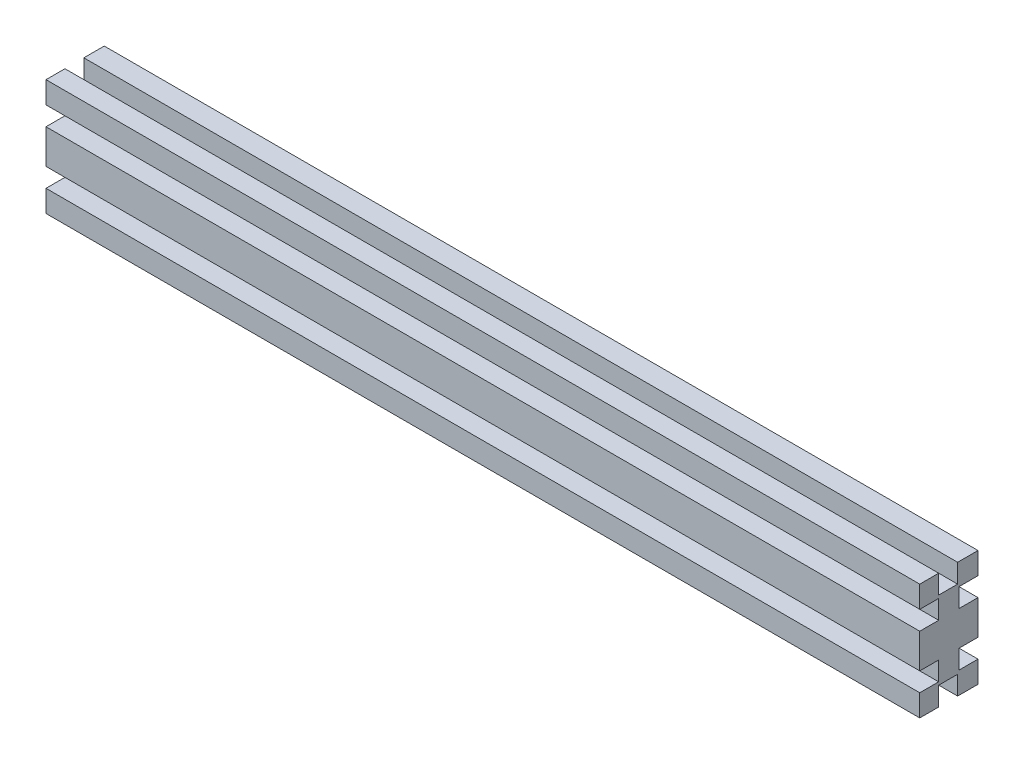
SolidWorks part; units mm, degrees
ref_plane "前视基准面" through (0, 0, 0) normal (0, 0, 1) x (1, 0, 0)
ref_plane "上视基准面" through (0, 0, 0) normal (0, 1, 0) x (1, 0, 0)
ref_plane "右视基准面" through (0, 0, 0) normal (1, 0, 0) x (0, 0, -1)
sketch "草图1" plane through (0, 0, 0) normal (1, 0, 0) x (0, 0, -1)
  line L1 (-10, 19.9007) -> (-3.5, 19.9007)
  line L2 (-10, 19.9007) -> (-10, 12.4007)
  line L3 (-10, -19.9007) -> (-3.5, -19.9007)
  line L4 (10, 19.9007) -> (10, 12.4007)
  line L5 (-10, 19.9007) -> (10, -19.9007) construction
  line L6 (-10, -19.9007) -> (10, 19.9007) construction
  line L7 (-10, 12.4007) -> (-3.5, 12.4007)
  line L9 (-10, 5.9007) -> (-3.5, 5.9007)
  line L10 (-3.5, 12.4007) -> (-3.5, 5.9007)
  line L11 (-10, -12.4007) -> (-3.5, -12.4007)
  line L12 (-10, -5.9007) -> (-3.5, -5.9007)
  line L13 (-3.5, -5.9007) -> (-3.5, -12.4007)
  line L15 (-3.5, 19.9007) -> (-3.5, 13.4007)
  line L16 (-3.5, 13.4007) -> (3, 13.4007)
  line L17 (3, 19.9007) -> (3, 13.4007)
  line L18 (0, 21.8908) -> (0, -21.8908) construction
  line L19 (10, -5.9007) -> (3.5, -5.9007)
  line L20 (3.5, -5.9007) -> (3.5, -12.4007)
  line L21 (10, -12.4007) -> (3.5, -12.4007)
  line L23 (10, 5.9007) -> (3.5, 5.9007)
  line L24 (3.5, 12.4007) -> (3.5, 5.9007)
  line L25 (10, 12.4007) -> (3.5, 12.4007)
  line L27 (11, 0) -> (-11, 0) construction
  line L28 (-3.5, -19.9007) -> (-3.5, -13.4007)
  line L29 (-3.5, -13.4007) -> (3, -13.4007)
  line L30 (3, -19.9007) -> (3, -13.4007)
  line L32 (-10, 5.9007) -> (-10, -5.9007)
  line L33 (3, 19.9007) -> (10, 19.9007)
  line L34 (10, 5.9007) -> (10, -5.9007)
  line L35 (10, -12.4007) -> (10, -19.9007)
  line L36 (-10, -12.4007) -> (-10, -19.9007)
  line L37 (3, -19.9007) -> (10, -19.9007)
  point P0 (0, 0)
  point P6 (-10, 12.4007)
  point P11 (0, 0)
  point P12 (0, 0)
  dimension "D1" = 6.5
  dimension "D2" = 6.5
  dimension "D3" = 7.5
  dimension "D5" = 7
  dimension "D6" = 6.5
  dimension "D7" = 20
  dimension "D9" = 7.5
  dimension "D10" = 6.5
extrude "凸台-拉伸1" add sketch "草图1" along normal blind 300
